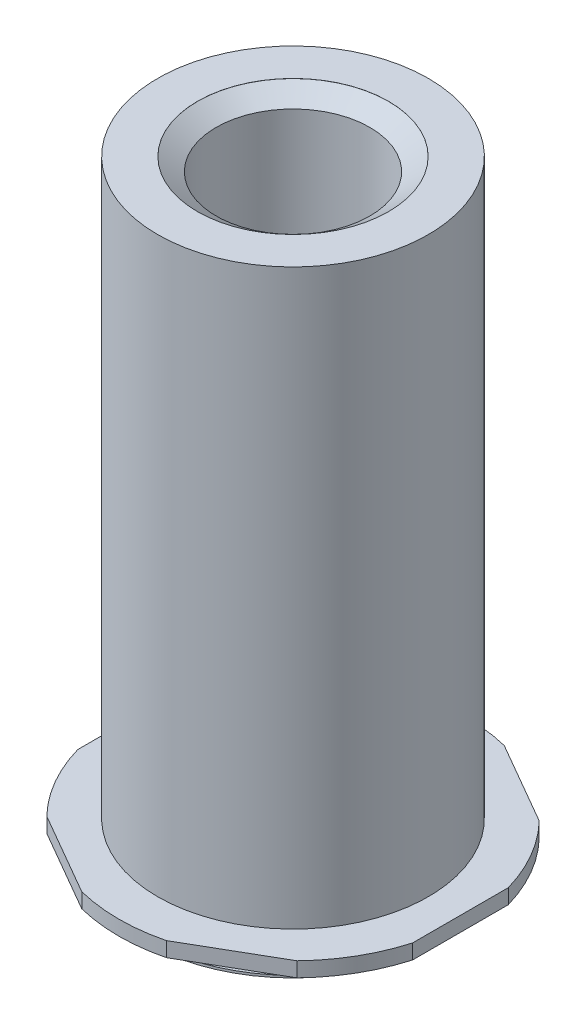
SolidWorks part; units mm, degrees
ref_plane "Plane1" through (0, 0, 0) normal (0, 0, 1) x (1, 0, 0)
ref_plane "Plane2" through (0, 0, 0) normal (0, 1, 0) x (1, 0, 0)
ref_plane "Plane3" through (0, 0, 0) normal (1, 0, 0) x (0, 0, -1)
sketch "BodySke" plane through (0, 0, 0) normal (0, 0, 1) x (1, 0, 0)
  line L0 (4.7321, 0) -> (5.7851, 0)
  line L1 (5.7851, 0) -> (5.7851, 0.4915)
  line L2 (5.7851, 0.4915) -> (4.4958, 0.4915)
  line L3 (2.5527, 19.5415) -> (2.5527, 10.0165)
  line L4 (0, -0.6007) -> (4.9403, -0.6007)
  line L5 (4.9403, -0.6007) -> (4.9403, -0.5245)
  line L6 (4.9403, -0.5245) -> (4.7321, -0.1638)
  line L7 (1.016, 18.2715) -> (3.6522, 18.2715) construction
  line L8 (4.4958, 19.5415) -> (2.5527, 19.5415)
  line L9 (0, 0) -> (0, 15.24) construction
  line L10 (4.7321, -0.1638) -> (4.7321, 0)
  line L11 (4.4958, 19.5415) -> (4.4958, 0.4915)
  line L12 (0, 10.0165) -> (2.5527, 10.0165)
  line L13 (0, 10.0165) -> (0, -0.6007)
  line L14 (1.016, 10.0165) -> (3.6522, 10.0165) construction
  line L15 (1.016, 10.0165) -> (3.6522, 10.0165) construction
  dimension "D1" = 60
  dimension "E_dia" = 11.5702
  dimension "C_dia" = 9.8806
  dimension "A_ht" = 0.6007
  dimension "Thread_min" = 5.1054
  dimension "C_len" = 0.0762
  dimension "Clinching_ht" = 0.1638
  dimension "Advance" = 1.27
  dimension "Thickness" = 1.0922
  dimension "B_dia" = 8.9916
  dimension "Length" = 19.05
  dimension "Thread_limit" = 9.525
  dimension "Thread_depth" = 9.525
  dimension "Drill_depth" = 9.525
revolve "Body" add sketch "BodySke"
revolve "EndChamfer" cut sketch "EndChamferSke" angle 360 about L0
sketch "EndChamferSke" plane through (0, 0, 0) normal (0, 0, 1) x (1, 0, 0)
  line L0 (0, -2.54) -> (0, 7.62) construction
  line L1 (0, 0) -> (0, 15.24) construction
  line L6 (3.175, 19.539) -> (2.5527, 19.1034)
  line L7 (3.175, 19.539) -> (3.175, 19.7955)
  line L8 (2.5527, 19.1034) -> (2.5527, 19.7955)
  line L9 (3.175, 19.7955) -> (2.5527, 19.7955)
  line L10 (4.4958, 19.5415) -> (-4.4958, 19.5415) construction
  dimension "D1" = 0.254
  dimension "Thread_nominal" = 6.35
  dimension "D2" = 34.99
  dimension "Thread_min" = 5.1054
  dimension "Inset" = 0.0025
revolve "TapDrill" cut sketch "TapDriSke" angle 360 about L0
sketch "TapDriSke" plane through (0, 0, 0) normal (0, 0, 1) x (1, 0, 0)
  line L0 (0, 0) -> (0, 15.24) construction
  line L1 (0, 0) -> (0, 15.24) construction
  line L2 (2.5527, 3.6665) -> (2.5527, 19.5415)
  line L3 (4.4958, 19.5415) -> (-4.4958, 19.5415) construction
  line L4 (2.5527, 3.6665) -> (0, 2.6091)
  line L5 (0, 2.6091) -> (0, 19.5415)
  line L6 (0, 19.5415) -> (2.5527, 19.5415)
  line L7 (2.5527, 10.0165) -> (2.5527, 19.5415) construction
  line L8 (0, 2.6091) -> (-2.5527, 3.6665) construction
  line L9 (-2.5527, 19.5415) -> (-2.5527, 10.0165) construction
  dimension "D1" = 135
  dimension "Depth" = 15.875
ref_plane "Plane4" through (0, -0.5486, 0) normal (0, 1, 0) x (-1, 0, 0)
sketch "ThdSchSke" plane through (0, 0, 0) normal (0, 0, 1) x (1, 0, 0)
  line L0 (0, -5.08) -> (0, 7.62) construction
  line L1 (0, 0) -> (0, 15.24) construction
  line L2 (0, 19.539) -> (3.175, 19.539) construction
  line L3 (3.175, 19.539) -> (-3.175, 19.539) construction
  line L4 (3.175, 19.539) -> (2.5527, 19.9747)
  line L6 (3.175, 19.539) -> (2.5527, 19.1032)
  line L7 (2.5527, 19.9747) -> (2.5527, 19.1032)
  dimension "Vee_angle" = 70
  dimension "Thread_nominal" = 6.35
  dimension "Thread_min" = 5.1054
revolve "ThreadSchematic" [suppressed] cut sketch "ThdSchSke" angle 360 about L0
pattern_linear "ThdSchPat" [suppressed]
sketch "HexDieSke" plane through (0, 0.4915, 0) normal (0, 1, 0) x (-1, 0, 0)
  line L0 (0, 6.4231) -> (5.5626, 3.2116)
  line L1 (5.5626, 3.2116) -> (5.5626, -3.2116)
  line L2 (5.5626, -3.2116) -> (0, -6.4231)
  line L3 (0, -6.4231) -> (-5.5626, -3.2116)
  line L4 (-5.5626, -3.2116) -> (-5.5626, 3.2116)
  line L5 (-5.5626, 3.2116) -> (0, 6.4231)
  circle A1 centre (0, 0) radius 5.5626 construction
  circle A2 centre (0, 0) radius 6.4231 construction
  circle A3 centre (0, 0) radius 6.4653
  dimension "Width_across_flats" = 11.1252
  dimension "OD" = 12.9306
extrude "HexDie" cut sketch "HexDieSke" against normal blind 0.4915
equation "' \"Length@BodySke\" = 0.75"
equation "' \"Thickness@BodySke\" = 0.043"
equation "' \"B_dia@BodySke\" = 0.354"
equation "' \"C_dia@BodySke\" = 0.389"
equation "' \"Width_across_flats@HexDieSke\" = 0.438"
equation "' \"E_dia@BodySke\" = \"Width_across_flats@HexDieSke\" * 1.04 ' varies by type (1.04 or 1.16)"
equation "' \"Thread_depth@BodySke\" = 0.375"
equation "' \"Drill_depth@BodySke\" = 0.375"
equation "' \"Advance@BodySke\" = 0.05"
equation "' \"Thread_min@BodySke\" = 0.201"
equation "' \"Thread_nominal@ThreadCosmetic\" = 0.25"
equation "\"Thread_limit@BodySke\" = ((sgn( \"Length@BodySke\" - \"Thread_depth@BodySke\" )-1)*( \"Length@BodySke\" - \"Thread_depth@BodySke\" ))/-2+ \"Thread_depth@BodySke\""
equation "\"Depth@TapDriSke\" = \"Thread_limit@BodySke\" + \"Advance@BodySke\" * 5"
equation "\"Depth@TapDriSke\" = ((sgn( \"Depth@TapDriSke\" - \"Drill_depth@BodySke\" )+1)*( \"Depth@TapDriSke\" - \"Drill_depth@BodySke\" ))/2 +\"Drill_depth@BodySke\""
equation "\"A_ht@BodySke\" = \"Thickness@BodySke\" * 0.55"
equation "\"Clinching_ht@BodySke\" = \"Thickness@BodySke\" * 0.15"
equation "\"C_len@BodySke\" =  0.003"
equation "\"Depth@HexDie\" = \"Thickness@BodySke\" - \"A_ht@BodySke\""
equation "\"OD@HexDieSke\" =  \"Width_across_flats@HexDieSke\" * 1.16 + 0.001"
equation "\"Thread_nominal@EndChamferSke\" = \"Thread_nominal@ThreadCosmetic\""
equation "\"Thread_min@EndChamferSke\" = \"Thread_min@BodySke\""
equation "\"D2@EndChamferSke\" = \"Vee_angle@ThdSchSke\" / 2 - 0.01"
equation "\"Thread_nominal@ThdSchSke\" = \"Thread_nominal@ThreadCosmetic\""
equation "\"Thread_min@ThdSchSke\" = \"Thread_min@BodySke\""
equation "\"Num_threads@ThdSchPat\" = int(  ( \"Thread_limit@BodySke\" - \"Inset@EndChamferSke\" ) / \"Advance@BodySke\" + 0.999 )  + 1"
equation "\"Advance@ThdSchPat\" = (  \"Thread_limit@BodySke\" - \"Inset@EndChamferSke\" ) /  (\"Num_threads@ThdSchPat\" - 1) 'relax it"
